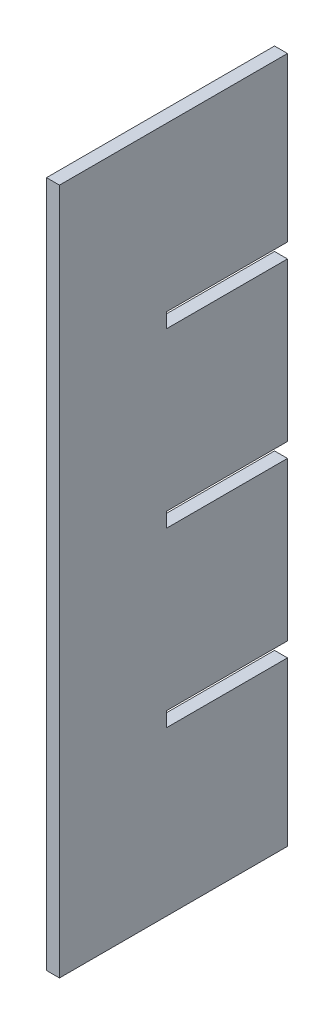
SolidWorks part; units mm, degrees
ref_plane "Alzado" through (0, 0, 0) normal (0, 0, 1) x (1, 0, 0)
ref_plane "Planta" through (0, 0, 0) normal (0, 1, 0) x (1, 0, 0)
ref_plane "Vista lateral" through (0, 0, 0) normal (1, 0, 0) x (0, 0, -1)
sketch "Croquis16" plane through (0, 0, 0) normal (0, 0, 1) x (1, 0, 0)
  line L0 (-18.25, -39.75) -> (-16.75, -39.75)
  line L1 (-18.5, -40) -> (-16.5, -40) construction
  line L2 (-18.5, -40) -> (-18.5, 40) construction
  line L3 (-18.5, 40) -> (-16.5, 40) construction
  line L4 (-16.5, -40) -> (-16.5, 40) construction
  line L5 (-16.75, -39.75) -> (-16.75, 39.75)
  line L6 (-18.25, 39.75) -> (-16.75, 39.75)
  line L7 (-18.25, -39.75) -> (-18.25, 39.75)
  dimension "D1" = 0.25
extrude "Saliente-Extruir9" add sketch "Croquis16" along normal blind 26.4
sketch "Croquis20" plane through (-16.75, 0, 0) normal (1, 0, 0) x (0, 0, -1)
  line L1 (0, -20.85) -> (-14, -20.85)
  line L2 (0, -20.85) -> (0, -19.15)
  line L3 (0, -19.15) -> (-14, -19.15)
  line L4 (-14, -20.85) -> (-14, -19.15)
  line L10 (0, -0.85) -> (-14, -0.85)
  line L11 (0, -0.85) -> (0, 0.85)
  line L12 (0, 0.85) -> (-14, 0.85)
  line L13 (-14, -0.85) -> (-14, 0.85)
  line L14 (0, 19.15) -> (-14, 19.15)
  line L15 (0, 19.15) -> (0, 20.85)
  line L16 (0, 20.85) -> (-14, 20.85)
  line L17 (-14, 19.15) -> (-14, 20.85)
  line L22 (0, -39.75) -> (0, 39.75) construction
  dimension "D1" = 1.7
  dimension "D2" = 14
  dimension "D4" = 1.7
  dimension "D5" = 1.7
  dimension "D6" = 14
  dimension "D7" = 14
extrude "Cortar-Extruir2" cut sketch "Croquis20" against normal up to surface (1.5 mm away)
